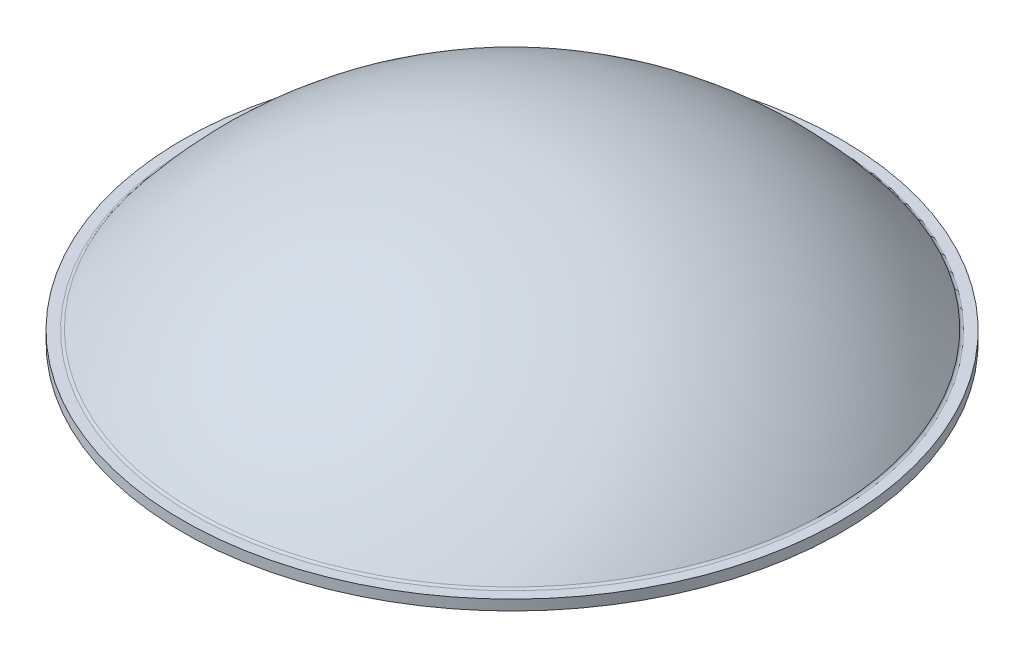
SolidWorks part; units mm, degrees
ref_plane "Front" through (0, 0, 0) normal (0, 0, 1) x (1, 0, 0)
ref_plane "Top" through (0, 0, 0) normal (0, 1, 0) x (1, 0, 0)
ref_plane "Right" through (0, 0, 0) normal (1, 0, 0) x (0, 0, -1)
sketch "Sketch1" plane through (0, 0, 0) normal (1, 0, 0) x (0, 0, -1)
  line L0 (0, 0) -> (0, 1.5875) construction
  line L1 (-3.175, 0) -> (3.175, 0) construction
  line L2 (0, 1.5875) -> (-3.175, 1.5875) construction
  line L3 (-3.175, 1.5875) -> (-3.175, 0) construction
sketch "Sketch2" plane through (0, 0, 0) normal (1, 0, 0) x (0, 0, -1)
  line L0 (-3.175, 0) -> (-3.175, 0.0992)
  line L1 (-3.175, 0.0992) -> (-3.0758, 0.0992)
  line L2 (0, 1.5875) -> (0, 0)
  line L3 (0, 0) -> (-3.175, 0)
  line L4 (0, 1.5875) -> (-3.175, 1.5875) construction
  arc A0 (-3.0498, 0.1118) -> (0, 1.5875) centre (0, -2.3019) cw
  arc A1 (-3.0498, 0.1118) -> (-3.0758, 0.0992) centre (-3.0758, 0.1323) cw
revolve "Revolve1" add sketch "Sketch2" angle 360 about L0
sketch "Sketch3" plane through (0, 0, 0) normal (0, 0, 1) x (1, 0, 0)
  line L0 (0, 1.5875) -> (-3.175, 1.5875) construction
  line L1 (0, 1.5875) -> (0, 0) construction
  line L2 (-3.175, 1.5875) -> (-3.175, 0) construction
  line L3 (-3.175, 0) -> (0, 0) construction
  line L4 (-3.175, 0) -> (3.175, 0) construction
  line L5 (-3.175, 0) -> (-3.186, 0) construction
sketch "Sketch4" plane through (0, 0, 0) normal (0, -1, 0) x (1, 0, 0)
  point P0 (0, 0)
equation "\"D1@Sketch2\"=\"Height@Sketch1\"/16"
equation "\"D2@Sketch2\"=\"D1@Sketch2\"/3"
equation "\"D1@Sketch3\"=\"D2@Sketch2\"/3"
